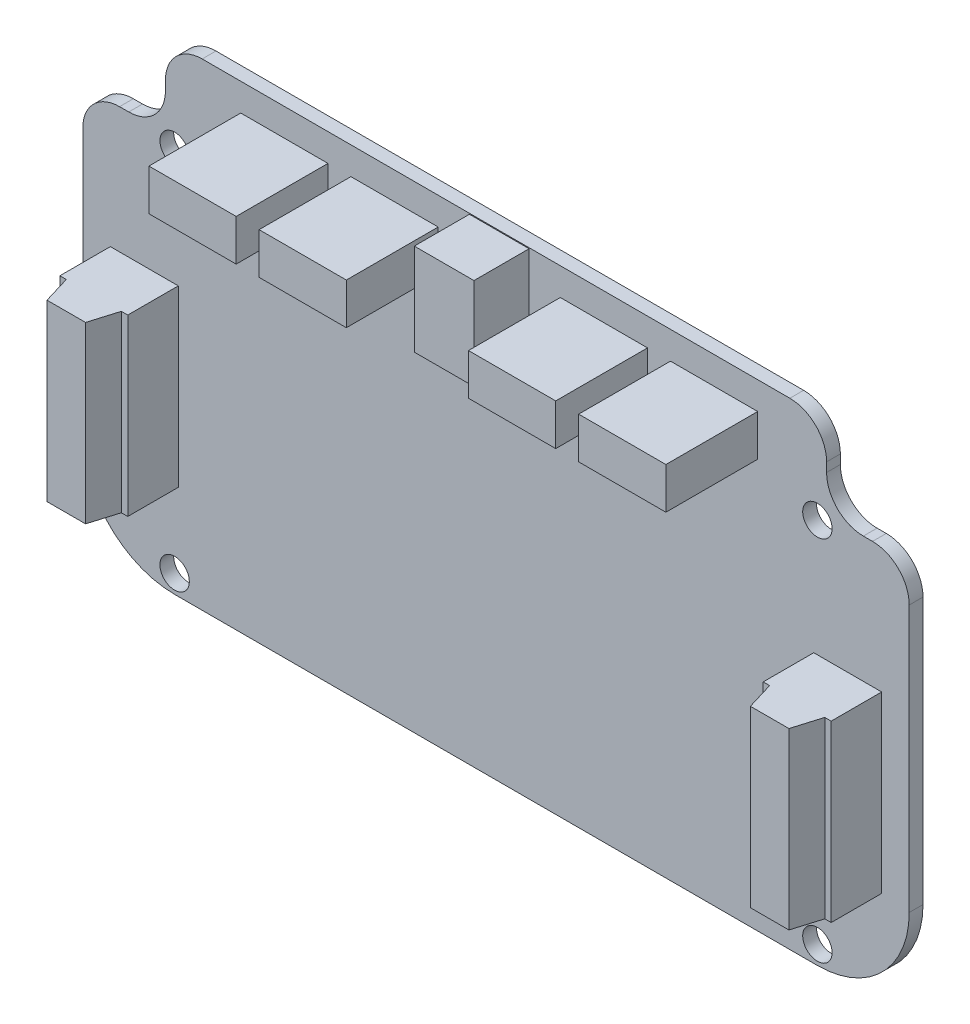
SolidWorks part; units mm, degrees
ref_plane "Plan de face" through (0, 0, 0) normal (0, 0, 1) x (1, 0, 0)
ref_plane "Plan de dessus" through (0, 0, 0) normal (0, 1, 0) x (1, 0, 0)
ref_plane "Plan de droite" through (0, 0, 0) normal (1, 0, 0) x (0, 0, -1)
sketch "Esquisse1" plane through (0, 0, 0) normal (0, 0, 1) x (1, 0, 0)
  line L1 (-10, 0) -> (-80, 0)
  line L2 (0, 10) -> (0, 39)
  line L3 (-13, 52) -> (-77, 52)
  line L4 (-90, 10) -> (-90, 39)
  line L5 (-80, 42) -> (-10, 42) construction
  line L6 (-81, 48) -> (-81, 47)
  line L7 (-85, 43) -> (-86, 43)
  line L8 (-80, 42) -> (-80, 2) construction
  line L9 (-80, 2) -> (-10, 2) construction
  line L10 (-9, 48) -> (-9, 47)
  line L11 (-5, 43) -> (-4, 43)
  line L12 (-10, 42) -> (-10, 2) construction
  arc A0 (0, 39) -> (-4, 43) centre (-4, 39) ccw
  arc A1 (-5, 43) -> (-9, 47) centre (-5, 47) cw
  arc A2 (-9, 48) -> (-13, 52) centre (-13, 48) ccw
  arc A3 (-77, 52) -> (-81, 48) centre (-77, 48) ccw
  arc A4 (-81, 47) -> (-85, 43) centre (-85, 47) cw
  arc A5 (-86, 43) -> (-90, 39) centre (-86, 39) ccw
  arc A6 (-10, 0) -> (0, 10) centre (-10, 10) ccw
  arc A7 (-80, 0) -> (-90, 10) centre (-80, 10) cw
  point P8 (0, 43)
  point P14 (-9, 43)
  point P17 (-9, 52)
  point P20 (-81, 52)
  point P23 (-81, 43)
  point P26 (-90, 43)
  point P29 (0, 0)
  point P32 (-90, 0)
  dimension "D7" = 4
  dimension "D8" = 10
  dimension "D1" = 52
  dimension "D2" = 90
  dimension "D3" = 9
  dimension "D4" = 9
  dimension "D5" = 9
  dimension "D6" = 9
  dimension "D9" = 40
  dimension "D10" = 70
  dimension "D11" = 10
  dimension "D12" = 10
extrude "Boss.-Extru.1" add sketch "Esquisse1" along normal blind 1.5
hole_wizard "Diamètre du perçage Ø3.2 (3.2)1" positions "Esquisse3" profile "Esquisse4" hole size "Ø3.2" standard "ISO"
sketch "Esquisse3" plane through (0, 0, 1.5) normal (0, 0, 1) x (1, 0, 0)
  point P0 (-80, 42)
  point P3 (-10, 42)
  point P6 (-10, 2)
  point P9 (-80, 2)
sketch "Esquisse4" plane through (-80, 42, 1.5) normal (1, 0, 0) x (0, -1, 0)
  line L0 (0, 0) -> (0, 1.5)
  line L1 (0, 1.5) -> (1.6, 1.5)
  line L2 (1.6, 1.5) -> (1.6, 0)
  line L5 (1.6, 0) -> (0, 0)
  line L11 (0, -6.35) -> (0, 107.95) construction
  dimension "Diamètre du perçage jusqu'au prochain" = 3.2
  dimension "Profondeur du perçage jusqu'au prochain" = 1.5
sketch "Esquisse5" plane through (0, 0, 1.5) normal (0, 0, 1) x (1, 0, 0)
  line L0 (-81, 48) -> (-81, 47) construction
  line L1 (-72.8, 49) -> (-63.3, 49)
  line L2 (-72.8, 49) -> (-72.8, 44.5)
  line L3 (-72.8, 44.5) -> (-63.3, 44.5)
  line L4 (-16.5, 49) -> (-16.5, 44.5)
  line L5 (-9, 47) -> (-9, 48) construction
  line L6 (-13, 52) -> (-77, 52) construction
  line L7 (-63.3, 49) -> (-63.3, 44.5)
  line L8 (-60.8, 49) -> (-60.8, 44.5)
  line L9 (-51.3, 49) -> (-51.3, 44.5)
  line L10 (-26, 49) -> (-26, 44.5)
  line L11 (-28.5, 49) -> (-28.5, 44.5)
  line L12 (-38, 49) -> (-38, 44.5)
  line L13 (-60.8, 49) -> (-51.3, 49)
  line L14 (-60.8, 44.5) -> (-51.3, 44.5)
  line L15 (-26, 49) -> (-16.5, 49)
  line L16 (-26, 44.5) -> (-16.5, 44.5)
  line L17 (-38, 49) -> (-28.5, 49)
  line L18 (-38, 44.5) -> (-28.5, 44.5)
  point P6 (-81, 47.5)
  dimension "D1" = 8.2
  dimension "D2" = 4.5
  dimension "D3" = 7.5
  dimension "D4" = 3
  dimension "D5" = 9.5
  dimension "D6" = 9.5
  dimension "D7" = 2.5
  dimension "D8" = 9.5
  dimension "D9" = 2.5
  dimension "D10" = 9.5
extrude "Boss.-Extru.2" add sketch "Esquisse5" along normal blind 10
sketch "Esquisse6" plane through (0, 0, 1.5) normal (0, 0, 1) x (1, 0, 0)
  line L0 (-13, 52) -> (-77, 52) construction
  line L1 (-47.9, 51.9) -> (-41.4, 51.9)
  line L2 (-47.9, 51.9) -> (-47.9, 41.9)
  line L3 (-47.9, 41.9) -> (-41.4, 41.9)
  line L4 (-41.4, 51.9) -> (-41.4, 41.9)
  line L5 (-38, 49) -> (-38, 44.5) construction
  dimension "D1" = 6.5
  dimension "D2" = 10
  dimension "D3" = 0.1
  dimension "D4" = 3.4
extrude "Boss.-Extru.3" add sketch "Esquisse6" along normal blind 6
ref_plane "Plan5" through (0, 10.3, 0) normal (0, -1, 0) x (-1, 0, 0)
sketch "Esquisse8" plane through (0, 10.3, 0) normal (0, -1, 0) x (-1, 0, 0)
  line L0 (80, -1.5) -> (90, -1.5) construction
  line L1 (87, -1.5) -> (79.6, -1.5)
  line L2 (87, -1.5) -> (87, -7)
  line L3 (87, -7) -> (86.3, -7)
  line L4 (79.6, -1.5) -> (79.6, -7)
  line L5 (90, -1.5) -> (90, 0) construction
  line L7 (81.2, -10) -> (85.4, -10)
  line L8 (85.4, -10) -> (86.3, -7)
  line L9 (81.2, -10) -> (80.3, -7)
  line L10 (80.3, -7) -> (79.6, -7)
  line L20 (80, -1.5) -> (10, -1.5) construction
  line L21 (3.7, -7) -> (3, -7)
  line L23 (10.4, -1.5) -> (3, -1.5)
  line L24 (4.6, -10) -> (8.8, -10)
  line L25 (10.4, -7) -> (9.7, -7)
  line L26 (10.4, -1.5) -> (10.4, -7)
  line L27 (3, -1.5) -> (3, -7)
  line L28 (4.6, -10) -> (3.7, -7)
  line L29 (8.8, -10) -> (9.7, -7)
  line L30 (0, -1.5) -> (0, 0) construction
  dimension "D1" = 7.4
  dimension "D2" = 3
  dimension "D3" = 5.5
  dimension "D4" = 6
  dimension "D5" = 0.7
  dimension "D6" = 7.4
  dimension "D7" = 4.2
  dimension "D8" = 1.6
  dimension "D9" = 5.5
  dimension "D10" = 6
  dimension "D11" = 0.7
  dimension "D12" = 4.2
  dimension "D13" = 1.6
  dimension "D14" = 3
  dimension "D15" = 3
extrude "Boss.-Extru.4" add sketch "Esquisse8" against normal blind 19
